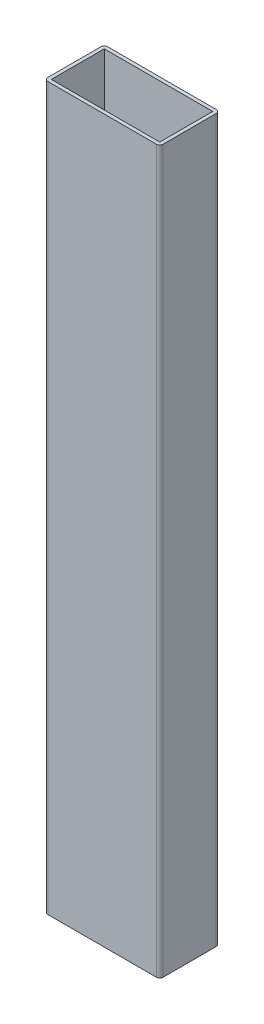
SolidWorks part; units mm, degrees
ref_plane "Front Plane" through (0, 0, 0) normal (0, 0, 1) x (1, 0, 0)
ref_plane "Top Plane" through (0, 0, 0) normal (0, 1, 0) x (1, 0, 0)
ref_plane "Right Plane" through (0, 0, 0) normal (1, 0, 0) x (0, 0, -1)
sketch "Sketch1" plane through (0, 0, 0) normal (0, 1, 0) x (1, 0, 0)
  line L1 (-24.8285, -13.716) -> (24.8285, -13.716)
  line L2 (-26.416, -12.1285) -> (-26.416, 12.1285)
  line L3 (-24.8285, 13.716) -> (24.8285, 13.716)
  line L4 (26.416, -12.1285) -> (26.416, 12.1285)
  line L5 (-26.416, -13.716) -> (26.416, 13.716) construction
  line L6 (-26.416, 13.716) -> (26.416, -13.716) construction
  arc A0 (-24.8285, -13.716) -> (-26.416, -12.1285) centre (-24.8285, -12.1285) cw
  arc A1 (24.8285, -13.716) -> (26.416, -12.1285) centre (24.8285, -12.1285) ccw
  arc A2 (24.8285, 13.716) -> (26.416, 12.1285) centre (24.8285, 12.1285) cw
  arc A3 (-26.416, 12.1285) -> (-24.8285, 13.716) centre (-24.8285, 12.1285) cw
  point P0 (0, 0)
  dimension "D3" = 1.5875
  dimension "D1" = 52.832
  dimension "D2" = 27.432
extrude "Extrude-Thin1" add sketch "Sketch1" along normal mid plane 330.2 thin
